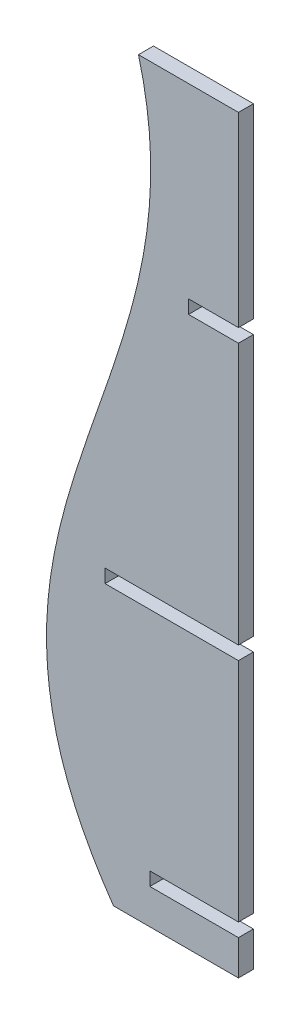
SolidWorks part; units mm, degrees
ref_plane "Front Plane" through (0, 0, 0) normal (0, 0, 1) x (1, 0, 0)
ref_plane "Top Plane" through (0, 0, 0) normal (0, 1, 0) x (1, 0, 0)
ref_plane "Right Plane" through (0, 0, 0) normal (1, 0, 0) x (0, 0, -1)
sketch "Sketch1" plane through (0, 0, 0) normal (0, 0, 1) x (1, 0, 0)
  line L0 (-60, -53.7652) -> (0, -53.7652) construction
  line L1 (0, -53.7652) -> (0, 96.2348) construction
  line L2 (0, 96.2348) -> (-55, 96.2348) construction
  line L3 (-55, 96.2348) -> (-40.2628, 41.2348) construction
  line L4 (-40.2628, 41.2348) -> (-98.5114, 1.2348) construction
  line L5 (-98.5114, 1.2348) -> (-60, -53.7652) construction
  line L6 (-35, 96.2348) -> (-35, 58.9348)
  line L7 (-60, -53.7652) -> (-35, -53.7652)
  line L8 (-35, 96.2348) -> (-55, 96.2348)
  line L14 (-45, 56.1425) -> (-45, 56.1425)
  line L15 (-35, -46.7652) -> (-35, -53.7652)
  line L16 (-52.7179, -44.0652) -> (-35, -44.0652)
  line L17 (-52.7179, -44.0652) -> (-52.7179, -46.7652)
  line L18 (-52.7179, -46.7652) -> (-35, -46.7652)
  line L20 (-52.7179, -44.0652) -> (-35, -46.7652) construction
  line L21 (-52.7179, -46.7652) -> (-35, -44.0652) construction
  line L22 (-35, 3.9348) -> (-61.6852, 3.9348)
  line L23 (-45, 56.1425) -> (-45, -43.7652) construction
  line L25 (-35, 1.2348) -> (-61.6852, 1.2348)
  line L26 (-61.6852, 3.9348) -> (-61.6852, 1.2348)
  line L27 (-35, 96.2348) -> (-35, -53.7652) construction
  line L28 (-35, 56.2348) -> (-35, 3.9348)
  line L29 (-35, 58.9348) -> (-44.98, 58.9348)
  line L31 (-35, 56.2348) -> (-44.98, 56.2348)
  line L32 (-44.98, 58.9348) -> (-44.98, 56.2348)
  line L33 (-35, 1.2348) -> (-35, -44.0652)
  line L34 (-54.6006, -43.7652) -> (-45, -43.7652) construction
  line L35 (-52.7179, -44.0652) -> (0, -44.0652) construction
  spline S0 degree 3 poles (-55, 96.2348) (-40.2628, 41.2348) (-98.5114, 1.2348) (-60, -53.7652) knots 0 0 0 0 1 1 1 1
  spline S1 degree 1 poles (-45, 56.1425) (-54.6006, -43.7652) knots 0 0 1 1 construction
  spline S2 degree 3 poles (-45, 56.1425) (-45.2637, 54.9295) (-45.8285, 52.5025) (-47.0654, 47.7466) (-48.787, 41.9312) (-51.0194, 35.1533) (-54.0803, 26.3505) (-57.7388, 15.9532) (-60.2377, 7.5054) (-61.4795, 2.2231) (-62.361, -1.9311) (-63.1864, -7.4747) (-63.4946, -13.8931) (-63.2088, -19.616) (-62.2937, -25.3797) (-60.9341, -30.2852) (-59.432, -34.3113) (-58.0827, -37.3892) (-56.7565, -40.0127) (-55.5715, -42.1404) (-54.9267, -43.2298) (-54.6006, -43.7652) knots 0.243674 0.243674 0.243674 0.243674 0.266393 0.289112 0.334551 0.37999 0.425429 0.516307 0.602674 0.614033 0.636753 0.698062 0.743501 0.78894 0.834379 0.879818 0.902537 0.925256 0.947976 0.959336 0.970695 0.970695 0.970695 0.970695 construction
  spline S3 degree 1 poles (-54.6006, -43.7652) (-52.7179, -46.7652) knots 0 0 1 1 construction
  point P13 (-43.859, -45.4152)
extrude "Boss-Extrude1" add sketch "Sketch1" along normal blind 3 contours L22 L26 L25 L33 L16 L17 L18 L15 L7 S0 L8 L6 L29 L32 L31 L28
sketch "Sketch3" plane through (0, 0, 3) normal (0, 0, 1) x (1, 0, 0)
  line L1 (-0.0007, -53.4652) -> (-0.0007, 96.5348)
  line L3 (-63.4438, -43.4878) -> (-0.0007, -43.4878)
  line L4 (-0.0007, -46.4878) -> (-63.4438, -46.4878)
  line L6 (-53.6067, 56.491) -> (-0.0007, 56.491)
  line L7 (-70.2431, 4.2348) -> (-0.0007, 4.2348)
  line L8 (-70.2431, 4.2348) -> (-70.2431, 1.5348)
  line L9 (-70.2431, 1.5348) -> (-0.0007, 1.5348)
  line L10 (-63.4438, -46.4878) -> (-63.4438, -43.4878)
  line L11 (-44.98, 58.9348) -> (-53.6067, 58.9348)
  line L12 (-53.6067, 58.9348) -> (-53.6067, 56.491)
  line L14 (-0.0007, 56.491) -> (-0.0007, 58.9348)
  line L15 (-35, 58.9348) -> (-35, 96.2348)
  line L16 (-35, 96.2348) -> (-55, 96.2348)
  line L17 (-60, -53.7652) -> (-35, -53.7652)
  line L18 (-35, -53.7652) -> (-35, -46.7652)
  line L19 (-35, -46.7652) -> (-52.7179, -46.7652)
  line L20 (-52.7179, -46.7652) -> (-52.7179, -44.0652)
  line L21 (-52.7179, -44.0652) -> (-35, -44.0652)
  line L22 (-35, -44.0652) -> (-35, 1.2348)
  line L23 (-35, 1.2348) -> (-61.6852, 1.2348)
  line L24 (-61.6852, 1.2348) -> (-61.6852, 3.9348)
  line L25 (-61.6852, 3.9348) -> (-35, 3.9348)
  line L26 (-35, 3.9348) -> (-35, 56.2348)
  line L27 (-35, 56.2348) -> (-44.98, 56.2348)
  line L28 (-44.98, 56.2348) -> (-44.98, 58.9348)
  line L29 (-44.98, 58.9348) -> (-35, 58.9348)
  line L30 (-35, 58.9348) -> (-35, 96.2348)
  line L31 (-35, 96.2348) -> (-55, 96.2348)
  line L32 (-60, -53.7652) -> (-35, -53.7652)
  line L33 (-35, -53.7652) -> (-35, -46.7652)
  line L37 (-35, -44.0652) -> (-35, 1.2348)
  line L41 (-35, 3.9348) -> (-35, 56.2348)
  line L44 (-44.98, 58.9348) -> (-35, 58.9348)
  line L45 (-0.0007, 58.9348) -> (-53.6067, 58.9348)
  line L46 (-36, 95.2348) -> (-53.7086, 95.2348)
  line L47 (-0.0007, -43.4878) -> (-0.0007, -46.4878)
  line L48 (-0.0007, -43.4878) -> (-0.0007, -46.4878)
  line L49 (-52.7179, -46.7652) -> (-52.7179, -44.0652) construction
  line L51 (-0.0007, 1.5348) -> (-0.0007, 4.2348)
  line L53 (-63.4438, -46.4878) -> (-63.4438, -43.4878)
  line L54 (-35, 3.9348) -> (-35, 1.2348)
  line L55 (-0.0007, -46.4878) -> (-0.0007, -43.4878)
  line L59 (-35, 58.9348) -> (-35, 56.2348)
  line L79 (-36, 0.2348) -> (-62.6852, 0.2348) construction
  line L80 (-62.6852, 0.2348) -> (-62.6852, 4.9348) construction
  line L81 (-62.6852, 4.9348) -> (-36, 4.9348) construction
  line L82 (-36, -43.0652) -> (-36, 0.2348) construction
  line L83 (-53.7179, -43.0652) -> (-36, -43.0652) construction
  line L84 (-53.7179, -46.7652) -> (-53.7179, -43.0652) construction
  line L85 (-36, 55.2348) -> (-45.98, 55.2348) construction
  line L86 (-36, 4.9348) -> (-36, 55.2348) construction
  line L87 (-45.98, 55.2348) -> (-45.98, 59.9348) construction
  line L88 (-45.98, 59.9348) -> (-36, 59.9348) construction
  line L89 (-36, 59.9348) -> (-36, 95.2348) construction
  line L90 (-61.6852, 3.9348) -> (-35, 3.9348) construction
  line L91 (-61.6852, 1.2348) -> (-61.6852, 3.9348) construction
  line L92 (-52.7179, -44.0652) -> (-35, -44.0652) construction
  line L93 (-36, -52.7652) -> (-36, -46.7652) construction
  line L94 (-59.4777, -52.7652) -> (-36, -52.7652) construction
  line L95 (-35, 1.2348) -> (-61.6852, 1.2348) construction
  line L96 (-44.98, 56.2348) -> (-44.98, 58.9348) construction
  line L97 (-35, 56.2348) -> (-44.98, 56.2348) construction
  spline S0 degree 1 poles (-53.7086, 95.2348) (-59.4777, -52.7652) knots 0 0 1 1 construction
  spline S1 degree 3 poles (-2915.3764, 972.474) (2976.473, -389.3977) (-3117.2872, 424.0667) (2831.5366, -833.7507) knots -2.169667 -2.169667 -2.169667 -2.169667 3.041967 3.041967 3.041967 3.041967 only from (-55, 96.2348) to (-60, -53.7652)
  spline S2 degree 3 poles (-55, 96.2348) (-40.2628, 41.2348) (-98.5114, 1.2348) (-60, -53.7652) knots 0 0 0 0 1 1 1 1
  spline S3 degree 3 poles (-53.7086, 95.2348) (-53.4964, 94.3831) (-53.1007, 92.662) (-52.4495, 89.2729) (-51.8751, 85.0778) (-51.5432, 80.1241) (-51.5346, 73.6147) (-52.1073, 67.3326) (-53.1296, 61.1651) (-53.9239, 57.3864) (-55.0489, 52.6982) (-56.7597, 46.5406) (-60.4345, 35.2397) (-65.3583, 21.7036) (-69.0292, 9.6946) (-71.0012, 0.8816) (-72.1354, -6.1789) (-72.5983, -14.8078) (-71.8503, -23.9113) (-70.0077, -31.6708) (-67.6797, -38.0129) (-65.7589, -42.2236) (-64.1416, -45.2693) (-63.2018, -46.9132) (-62.3424, -48.3704) (-61.1806, -50.2455) (-60.0502, -51.9378) (-59.4777, -52.7652) knots 0.007541 0.007541 0.007541 0.007541 0.023007 0.038474 0.069406 0.100339 0.131272 0.193137 0.222329 0.253262 0.268728 0.316868 0.378733 0.502464 0.601964 0.632897 0.68806 0.749925 0.81179 0.873656 0.904588 0.935521 0.954579 0.962312 0.966454 0.98192 0.997386 0.997386 0.997386 0.997386 construction
equation "\"t\"= 3mm"
equation "\"k\"= .15mm"
equation "\"s\"= \"t\" - ( 2 * \"k\" )"
equation "\"t@Sketch1\"=\"s\""
equation "\"D13@Sketch1\"=\"s\""
equation "\"D10@Sketch1\"=\"s\""
equation "\"D12@Sketch3\"=\"s\""
